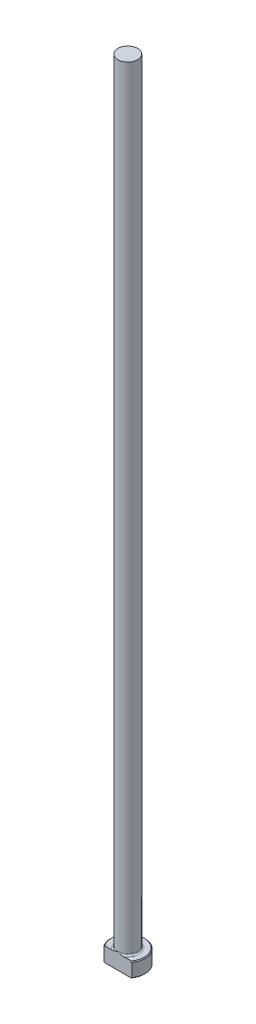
SolidWorks part; units mm, degrees
ref_plane "Front Plane" through (0, 0, 0) normal (0, 0, 1) x (1, 0, 0)
ref_plane "Top Plane" through (0, 0, 0) normal (0, 1, 0) x (1, 0, 0)
ref_plane "Right Plane" through (0, 0, 0) normal (1, 0, 0) x (0, 0, -1)
sketch "Sketch1" plane through (0, 0, 0) normal (0, 0, 1) x (1, 0, 0)
  line L0 (0, 259.9588) -> (0, -15.1925) construction
  line L1 (0, 0) -> (-5.5499, 0)
  line L2 (-5.5499, 0) -> (-5.5499, 4.7498)
  line L3 (-5.5499, 4.7498) -> (-3.175, 4.7498)
  line L4 (-3.175, 4.7498) -> (-3.175, 254)
  line L5 (-3.175, 254) -> (0, 254)
  line L6 (0, 254) -> (0, 0)
  dimension "L" = 254
  dimension "H" = 11.0998
  dimension "T" = 4.7498
  dimension "D" = 6.35
revolve "Revolve1" add sketch "Sketch1" angle 360 about L0
chamfer "Chamfer1" distance 0.254 angle 45 2 edges at (0, 4.7498, 5.5499) (0, 0, 5.5499)
fillet "Fillet1" radius 0.508 1 edges at (0, 4.7498, 3.175)
sketch "Sketch2" plane through (0, 0, 0) normal (0, 1, 0) x (1, 0, 0)
  line L0 (-4.552, -3.175) -> (4.552, -3.175)
  circle A0 centre (0, 0) radius 5.5499 construction
  arc A1 (-4.552, -3.175) -> (4.552, -3.175) centre (0, 0) ccw
  circle A3 centre (0, 0) radius 3.175 construction
  dimension "D1" = 0
extrude "Key" cut sketch "Sketch2" along normal through all
sketch "Pocket Sketch" plane through (0, 0, 0) normal (0, 0, 1) x (1, 0, 0)
  line L0 (-5.9468, 0) -> (-5.9468, 4.7752)
  line L1 (-5.9468, 4.7752) -> (-4.3339, 4.7752)
  line L2 (-3.5719, 5.5372) -> (-3.5719, 22.225)
  line L3 (-3.5719, 22.225) -> (0, 22.225)
  line L4 (0, 22.225) -> (0, 0)
  line L5 (0, 0) -> (-5.9468, 0)
  line L6 (0, 12.6104) -> (0, -2.4989) construction
  line L7 (-5.5499, 4.4958) -> (-5.5499, 0.254) construction
  line L8 (5.2959, 4.7498) -> (-5.2959, 4.7498) construction
  line L9 (-3.175, 254) -> (-3.175, 5.2578) construction
  line L10 (-4.3339, 4.7752) -> (-3.5719, 5.5372)
  point P3 (-3.5719, 4.7752)
  dimension "D1" = 11.8935
  dimension "D2" = 0.3969
  dimension "D3" = 0.0254
  dimension "D4" = 0.3969
  dimension "D5" = 7.1437
  dimension "D6" = 22.225
